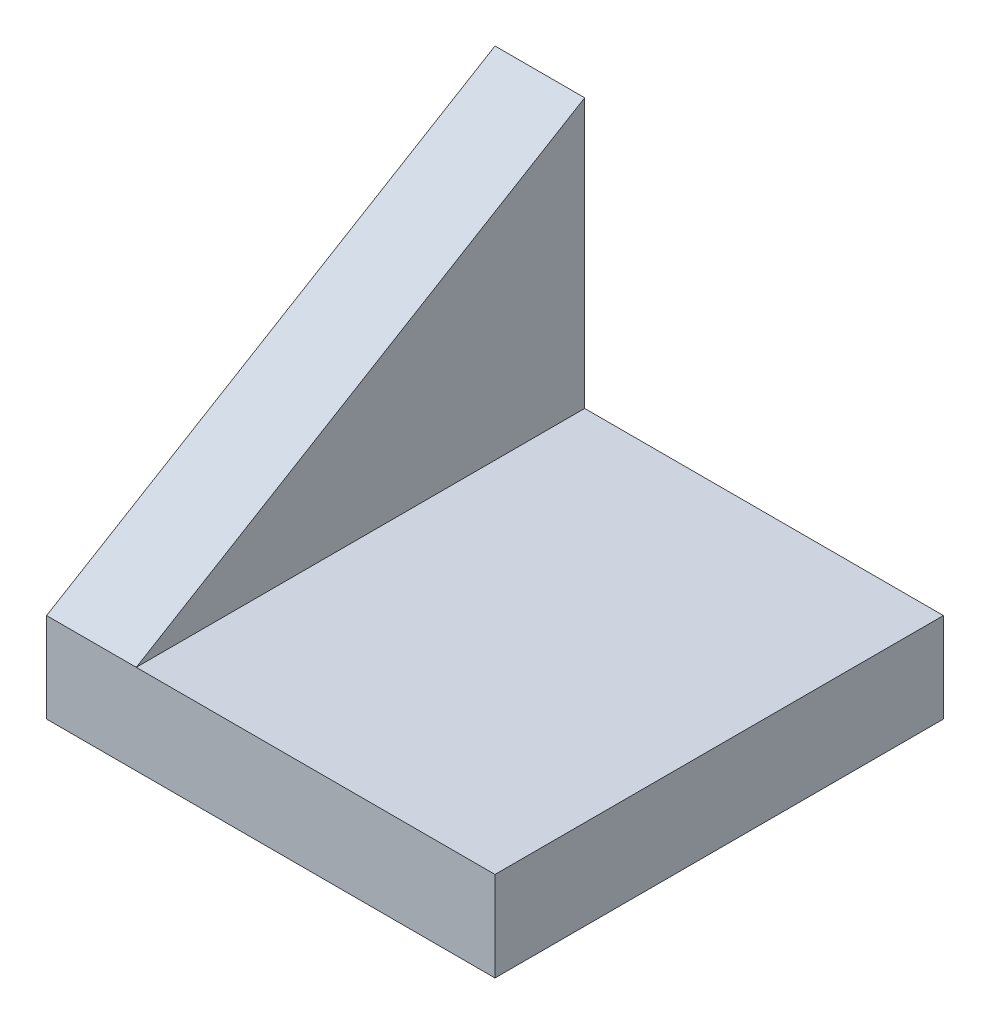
SolidWorks part; units mm, degrees
ref_plane "Front Plane" through (0, 0, 0) normal (0, 0, 1) x (1, 0, 0)
ref_plane "Top Plane" through (0, 0, 0) normal (0, 1, 0) x (1, 0, 0)
ref_plane "Right Plane" through (0, 0, 0) normal (1, 0, 0) x (0, 0, -1)
sketch "Sketch4" plane through (0, 0, 0) normal (0, 1, 0) x (1, 0, 0)
  line L1 (-25.9454, 18.2773) -> (24.0546, 18.2773)
  line L2 (-25.9454, 18.2773) -> (-25.9454, -31.7227)
  line L3 (-25.9454, -31.7227) -> (24.0546, -31.7227)
  line L4 (24.0546, 18.2773) -> (24.0546, -31.7227)
  dimension "D1" = 50
  dimension "D2" = 50
extrude "Boss-Extrude1" add sketch "Sketch4" along normal blind 10 contours L4 L3 L2 L1
sketch "Sketch6" plane through (-25.9454, 0, 0) normal (-1, 0, 0) x (0, 0, 1)
  line L0 (-18.2773, 10) -> (-18.2773, 40)
  line L1 (-18.2773, 40) -> (31.7227, 10)
  line L2 (31.7227, 10) -> (-18.2773, 10)
  dimension "D1" = 30
extrude "Boss-Extrude2" add sketch "Sketch6" against normal blind 10
